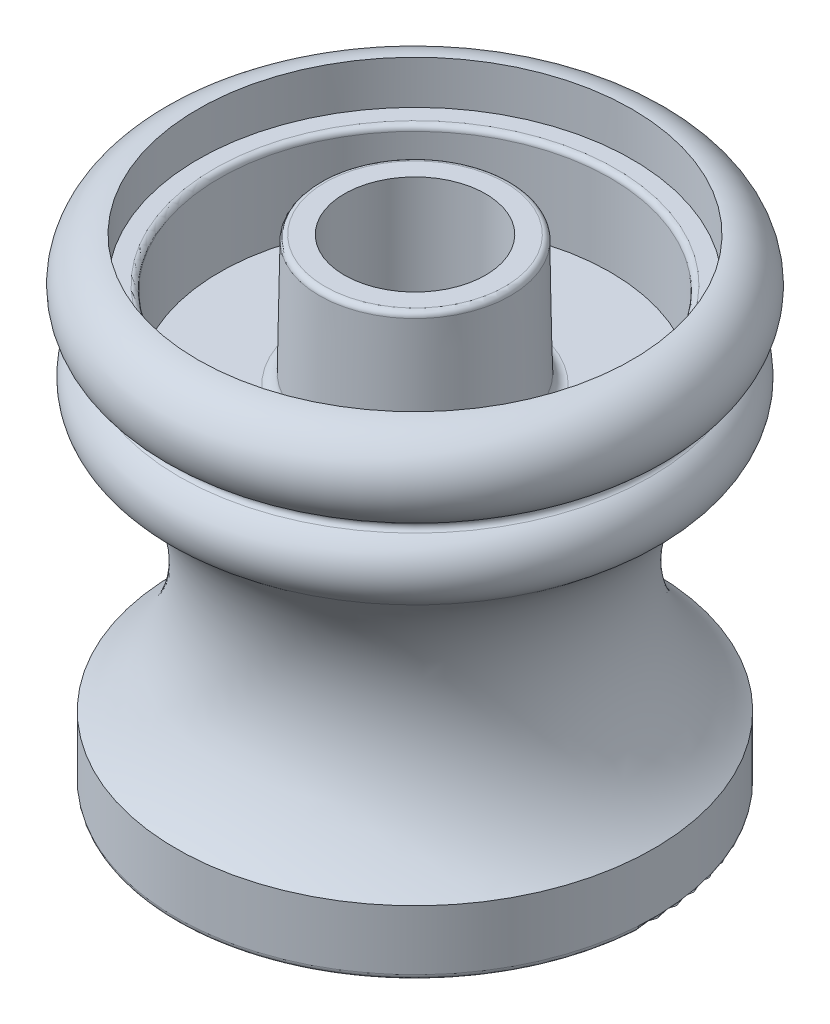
SolidWorks part; units mm, degrees
ref_plane "Plane1" through (0, 0, 0) normal (0, 0, 1) x (1, 0, 0)
ref_plane "Plane2" through (0, 0, 0) normal (0, 1, 0) x (1, 0, 0)
ref_plane "Plane3" through (0, 0, 0) normal (1, 0, 0) x (0, 0, -1)
sketch "Sketch1" plane through (0, 0, 0) normal (0, 0, 1) x (1, 0, 0)
  line L0 (0, 0) -> (11, 0)
  line L1 (11, 0) -> (11, 3)
  line L2 (0, 0) -> (0, 38.5764) construction
  line L3 (10, 22) -> (0, 22)
  line L4 (0, 22) -> (0, 0)
  arc A0 (11, 3) -> (11, 15) centre (15.5, 9) cw
  arc A1 (11, 15) -> (10.8569, 17.7628) centre (10, 16.3333) ccw
  arc A2 (10.8759, 18.202) -> (10, 22) centre (10, 20) ccw
  arc A3 (10.8569, 17.7628) -> (10.8759, 18.202) centre (10.9854, 17.9773) cw
  point P14 (10, 18)
  dimension "D4" = 8
  dimension "D6" = 10
  dimension "D8" = 10
  dimension "D9" = 0.25
  dimension "D1" = 11
  dimension "D2" = 3
  dimension "D3" = 12
  dimension "D5" = 3
  dimension "D7" = 22
revolve "Base-Revolve" add sketch "Sketch1" angle 360 about L2
hole_wizard "CounterSunk Hole" positions "Sketch7" profile "Sketch6" legacy
sketch "Sketch7" plane through (0, 0, 0) normal (0, -1, 0) x (1, 0, 0)
  point P0 (0, 0)
sketch "Sketch6" plane through (0, 0, 0) normal (1, 0, 0) x (0, 0, -1)
  line L0 (0, 0) -> (0, 12)
  line L1 (0, 12) -> (4.5, 12)
  line L2 (4.5, 12) -> (4.5, 0.546)
  line L3 (4.5, 0.546) -> (6, 0)
  line L4 (6, 0) -> (0, 0)
  line L5 (0, -6.4453) -> (0, 115.525) construction
  line L6 (-4.5, 0.546) -> (-6, 0) construction
  dimension "Diameter" = 9
  dimension "Depth" = 12
  dimension "C-Sink Angle" = 140
  dimension "C-Sink Diameter" = 12
sketch "Sketch2" plane through (0, 22, 0) normal (0, 1, 0) x (-1, 0, 0)
  circle A0 centre (0, 0) radius 10 construction
  circle A1 centre (0, 0) radius 10
extrude "Cut-Extrude1" cut sketch "Sketch2" against normal blind 2
sketch "Sketch3" plane through (0, 20, 0) normal (0, 1, 0) x (-1, 0, 0)
  circle A1 centre (0, 0) radius 9
  circle A2 centre (0, 0) radius 9
  dimension "D1" = 1
extrude "Cut-Extrude2" cut sketch "Sketch3" against normal blind 4
sketch "Sketch4" plane through (0, 16, 0) normal (0, 1, 0) x (-1, 0, 0)
  circle A0 centre (0, 0) radius 4.5
  dimension "D1" = 9
extrude "Boss-Extrude1" add sketch "Sketch4" along normal blind 6 draft 1
sketch "Sketch5" plane through (0, 22, 0) normal (0, 1, 0) x (-1, 0, 0)
  circle A0 centre (0, 0) radius 3.25
  dimension "D1" = 6.5
extrude "Cut-Extrude3" cut sketch "Sketch5" against normal through all
fillet "Fillet1" radius 0.25 3 edges at (0, 0, -11) (0, 22, 4.3953) (0, 20, 9)
fillet "Fillet2" radius 0.5 1 edges at (0, 16, 4.5)
